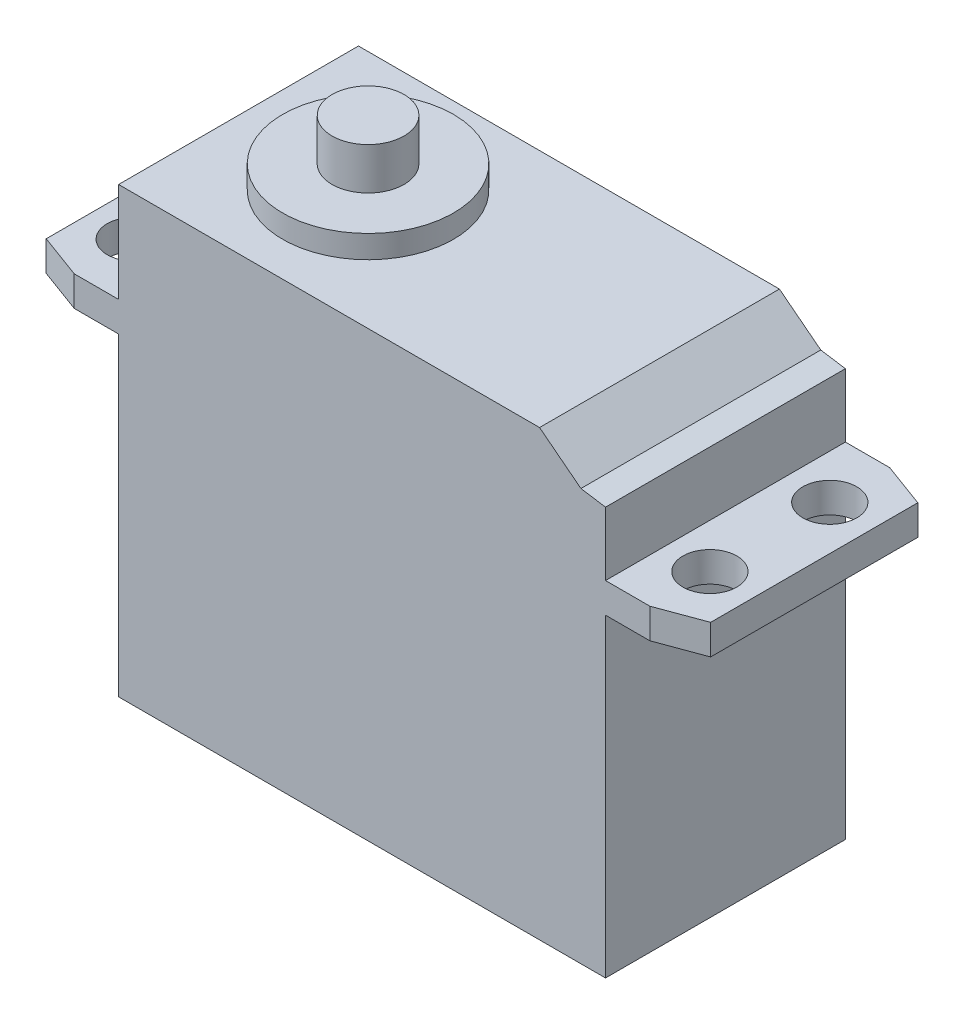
SolidWorks part; units mm, degrees
ref_plane "Front Plane" through (0, 0, 0) normal (0, 0, 1) x (1, 0, 0)
ref_plane "Top Plane" through (0, 0, 0) normal (0, 1, 0) x (1, 0, 0)
ref_plane "Right Plane" through (0, 0, 0) normal (1, 0, 0) x (0, 0, -1)
sketch "Sketch1" plane through (0, 0, 0) normal (0, 1, 0) x (1, 0, 0)
  line L1 (0, 0) -> (40.6, 0)
  line L2 (0, 0) -> (0, 20)
  line L3 (0, 20) -> (40.6, 20)
  line L4 (40.6, 0) -> (40.6, 20)
  dimension "D1" = 40.6
  dimension "D2" = 20
extrude "Body Main Extrude" add sketch "Sketch1" along normal blind 37
sketch "Sketch2" plane through (40.6, 0, 0) normal (1, 0, 0) x (0, 0, -1)
  line L0 (0, 37) -> (0, 0) construction
  line L1 (0, 28.7) -> (20, 28.7)
  line L2 (0, 28.7) -> (0, 26.2)
  line L3 (0, 26.2) -> (20, 26.2)
  line L4 (20, 28.7) -> (20, 26.2)
  line L5 (20, 37) -> (20, 0) construction
  line L6 (0, 0) -> (20, 0) construction
  dimension "D1" = 2.5
  dimension "D2" = 26.2
extrude "Mount Tab Extrude" add sketch "Sketch2" along normal blind 7.4
sketch "Sketch3" plane through (0, 28.7, 0) normal (0, 1, 0) x (1, 0, 0)
  line L0 (48, 20) -> (40.6, 20) construction
  line L1 (48, 10) -> (40.6, 10) construction
  line L2 (48, 20) -> (48, 0) construction
  line L3 (40.6, 20) -> (40.6, 0) construction
  line L4 (44.3, 20) -> (48, 18.6357)
  line L5 (44.3, 20) -> (48, 20)
  line L6 (48, 20) -> (48, 18.6357)
  line L7 (48, 0) -> (48, 1.3643)
  line L8 (44.3, 0) -> (48, 1.3643)
  line L9 (44.3, 0) -> (48, 0)
  circle A0 centre (44.3, 15) radius 2.25
  circle A1 centre (44.3, 5) radius 2.25
  dimension "D1" = 4.5
  dimension "D2" = 5
extrude "Mounting Holes" cut sketch "Sketch3" against normal up to next
ref_plane "Midplane" through (20.3, 0, 0) normal (1, 0, 0) x (0, 0, -1)
mirror "Mount Tab Mirror" about plane through (20.3, 0, 0) normal (1, 0, 0) of "Mounting Holes", "Mount Tab Extrude"
sketch "Sketch4" plane through (0, 37, 0) normal (0, 1, 0) x (1, 0, 0)
  line L0 (0, 10) -> (40.6, 10) construction
  line L1 (0, 20) -> (0, 0) construction
  line L2 (40.6, 0) -> (40.6, 20) construction
  circle A0 centre (10.8, 10) radius 7.125
  circle A1 centre (-3.7, 15) radius 2.25 construction
  dimension "D1" = 14.25
  dimension "D2" = 14.5
extrude "Surrounding Spline Boss" add sketch "Sketch4" along normal blind 1.9
sketch "Sketch5" plane through (0, 38.9, 0) normal (0, 1, 0) x (1, 0, 0)
  circle A0 centre (10.8, 10) radius 3
  dimension "D1" = 6
extrude "Spline" add sketch "Sketch5" along normal blind 3.5
sketch "Sketch7" plane through (0, 0, 0) normal (0, 0, 1) x (1, 0, 0)
  line L0 (40.6, 37) -> (40.6, 28.7) construction
  line L1 (35.1, 37) -> (40.6, 37)
  line L4 (40.6, 37) -> (40.6, 34)
  line L5 (0, 37) -> (40.6, 37) construction
  line L6 (40.6, 34) -> (38.5477, 34.3219)
  line L7 (38.5477, 34.3219) -> (35.1, 37)
extrude "OrnamentalCut" cut sketch "Sketch7" against normal up to next
sketch "Sketch8" plane through (0, 0, 0) normal (-1, 0, 0) x (0, 0, 1)
  line L0 (-20, 0) -> (0, 0) construction
  line L1 (-13.375, 0) -> (-6.625, 0)
  line L2 (-13.375, 0) -> (-13.375, 3.7)
  line L3 (-13.375, 3.7) -> (-6.625, 3.7)
  line L4 (-6.625, 0) -> (-6.625, 3.7)
  point P6 (-10, 0)
  dimension "D1" = 3.7
  dimension "D2" = 6.75
extrude "Boss-Extrude6" add sketch "Sketch8" along normal blind 2
